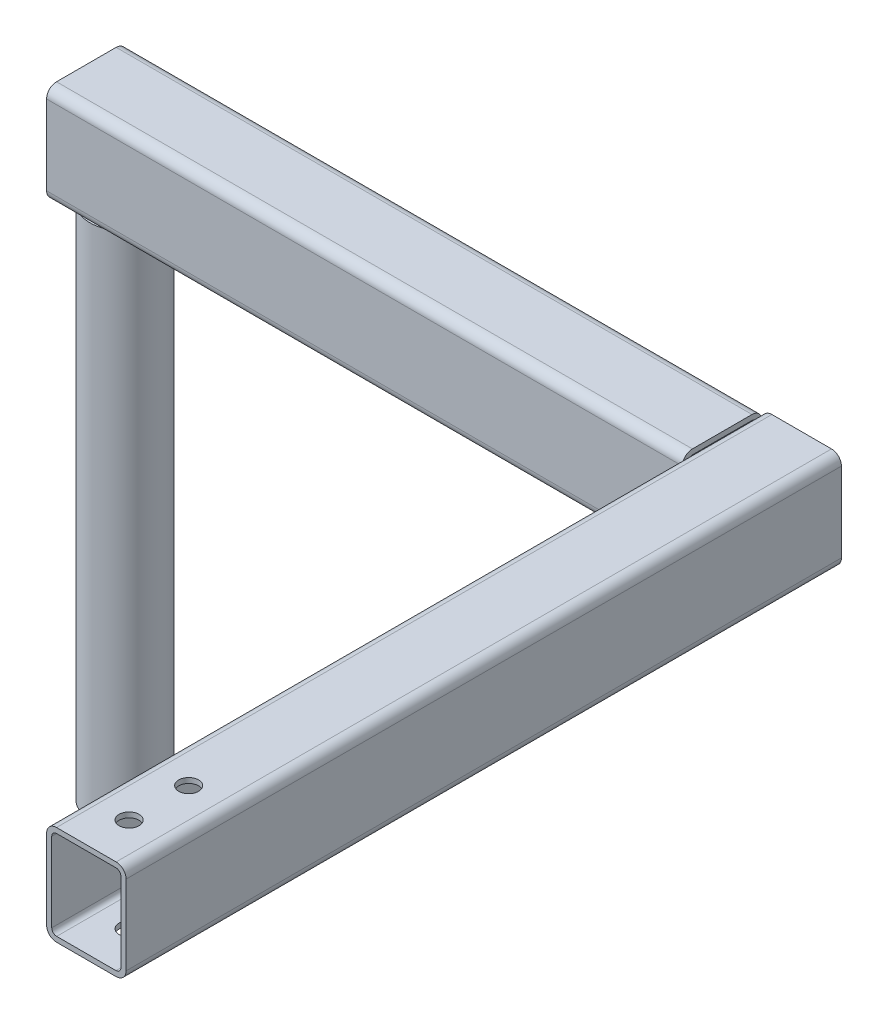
SolidWorks part; units mm, degrees
ref_plane "Front Plane" through (0, 0, 0) normal (0, 0, 1) x (1, 0, 0)
ref_plane "Top Plane" through (0, 0, 0) normal (0, 1, 0) x (1, 0, 0)
ref_plane "Right Plane" through (0, 0, 0) normal (1, 0, 0) x (0, 0, -1)
sketch "Sketch1" plane through (0, 0, 0) normal (0, 0, 1) x (1, 0, 0)
  line L1 (12.7, 15.875) -> (-12.7, 15.875)
  line L2 (12.7, 15.875) -> (12.7, -15.875)
  line L3 (12.7, -15.875) -> (-12.7, -15.875)
  line L4 (-12.7, 15.875) -> (-12.7, -15.875)
  line L5 (12.7, 15.875) -> (-12.7, -15.875) construction
  line L6 (12.7, -15.875) -> (-12.7, 15.875) construction
  point P0 (0, 0)
  dimension "D1" = 25.4
  dimension "D2" = 31.75
extrude "Extrude-Thin1" add sketch "Sketch1" along normal blind 228.6 thin
fillet "Fillet1" radius 1.5748 4 edges at (11.049, -14.224, 114.3) (11.049, 14.224, 114.3) (-11.049, 14.224, 114.3) (-11.049, -14.224, 114.3)
fillet "Fillet2" radius 3.175 4 edges at (-12.7, -15.875, 114.3) (12.7, -15.875, 114.3) (12.7, 15.875, 114.3) (-12.7, 15.875, 114.3)
sketch "Sketch2" plane through (0, 0, 0) normal (1, 0, 0) x (0, 0, -1)
  line L0 (0, -15.875) -> (-228.6, -15.875) construction
  line L1 (-25.4, 15.875) -> (0, 15.875)
  line L2 (-25.4, 15.875) -> (-25.4, -15.875)
  line L3 (-25.4, -15.875) -> (0, -15.875)
  line L4 (0, 15.875) -> (0, -15.875)
  line L5 (-25.4, 15.875) -> (0, -15.875) construction
  line L6 (-25.4, -15.875) -> (0, 15.875) construction
  line L7 (-228.6, 15.875) -> (0, 15.875) construction
  point P0 (-12.7, 0)
  dimension "D1" = 25.4
extrude "Extrude-Thin2" add sketch "Sketch2" against normal blind 203.2 from offset 12.7 separate body thin
fillet "Fillet3" radius 3.175 4 edges at (-114.3, 15.875, 0) (-114.3, -15.875, 0) (-114.3, -15.875, 25.4) (-114.3, 15.875, 25.4)
fillet "Fillet4" radius 1.651 4 edges at (-114.3, -14.224, 1.651) (-114.3, -14.224, 23.749) (-114.3, 14.224, 23.749) (-114.3, 14.224, 1.651)
sketch "Sketch3" plane through (0, -15.875, 0) normal (0, -1, 0) x (1, 0, 0)
  line L0 (-215.9, 22.225) -> (-215.9, 3.175) construction
  circle A0 centre (-203.2, 13.0565) radius 11.1125
  dimension "D1" = 22.225
  dimension "D2" = 12.7
extrude "Extrude-Thin3" add sketch "Sketch3" along normal blind 165.1 separate body thin
sketch "Sketch4" plane through (0, 15.875, 0) normal (0, 1, 0) x (1, 0, 0)
  line L0 (9.525, -228.6) -> (-9.525, -228.6) construction
  circle A0 centre (0, -214.9348) radius 3.175
  circle A1 centre (0, -195.8848) radius 3.175
  dimension "D3" = 6.35
  dimension "D1" = 13.6652
  dimension "D2" = 19.05
extrude "Cut-Extrude1" cut sketch "Sketch4" against normal blind 48.26
